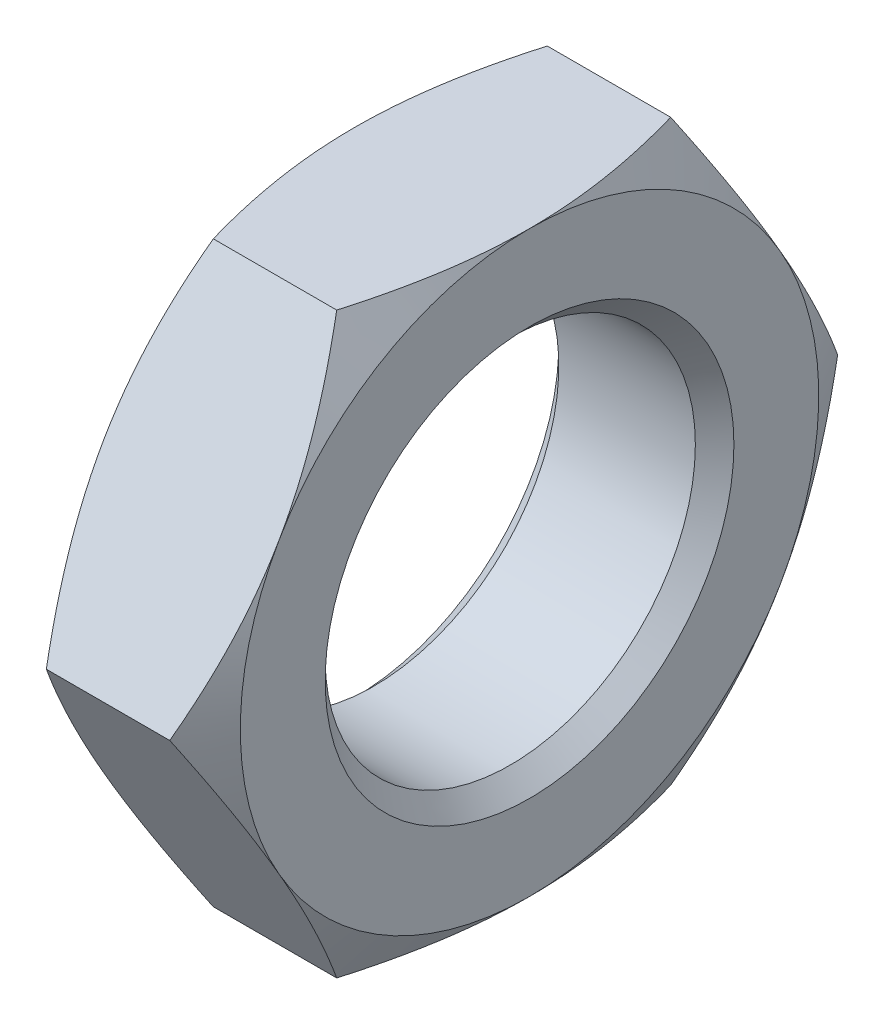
SolidWorks part; units mm, degrees
ref_plane "Front Plane" through (0, 0, 0) normal (0, 0, 1) x (1, 0, 0)
ref_plane "Top Plane" through (0, 0, 0) normal (0, 1, 0) x (1, 0, 0)
ref_plane "Right Plane" through (0, 0, 0) normal (1, 0, 0) x (0, 0, -1)
sketch "Sketch1" plane through (0, 0, 0) normal (1, 0, 0) x (0, 0, -1)
  line L1 (21.6506, 37.5) -> (-21.6506, 37.5)
  line L2 (-21.6506, 37.5) -> (-43.3013, 0)
  line L3 (-43.3013, 0) -> (-21.6506, -37.5)
  line L4 (-21.6506, -37.5) -> (21.6506, -37.5)
  line L5 (21.6506, -37.5) -> (43.3013, 0)
  line L6 (43.3013, 0) -> (21.6506, 37.5)
  circle A0 centre (0, 0) radius 37.5 construction
  circle A1 centre (0, 0) radius 24
extrude "Extrude1" add sketch "Sketch1" along normal blind 22.7
sketch "Sketch2" plane through (0, 0, 0) normal (0, 0, 1) x (1, 0, 0)
  line L0 (22.7, 37.5) -> (22.7, 150)
  line L1 (22.7, 150) -> (0, 150)
  line L2 (0, 150) -> (0, 37.5)
  line L3 (0, 37.5) -> (11.35, 57.1588)
  line L4 (11.35, 57.1588) -> (22.7, 37.5)
revolve "Cut-Revolve1" cut sketch "Sketch2" angle 360 about axis through (22.7, 0, 0) along (-1, 0, 0)
chamfer "Chamfer1" distance 2.5 angle 45 2 edges at (0, 0, -24) (22.7, 0, -24)
equation "\"D2@Sketch2\"=\"D1@Sketch1\"*2"
